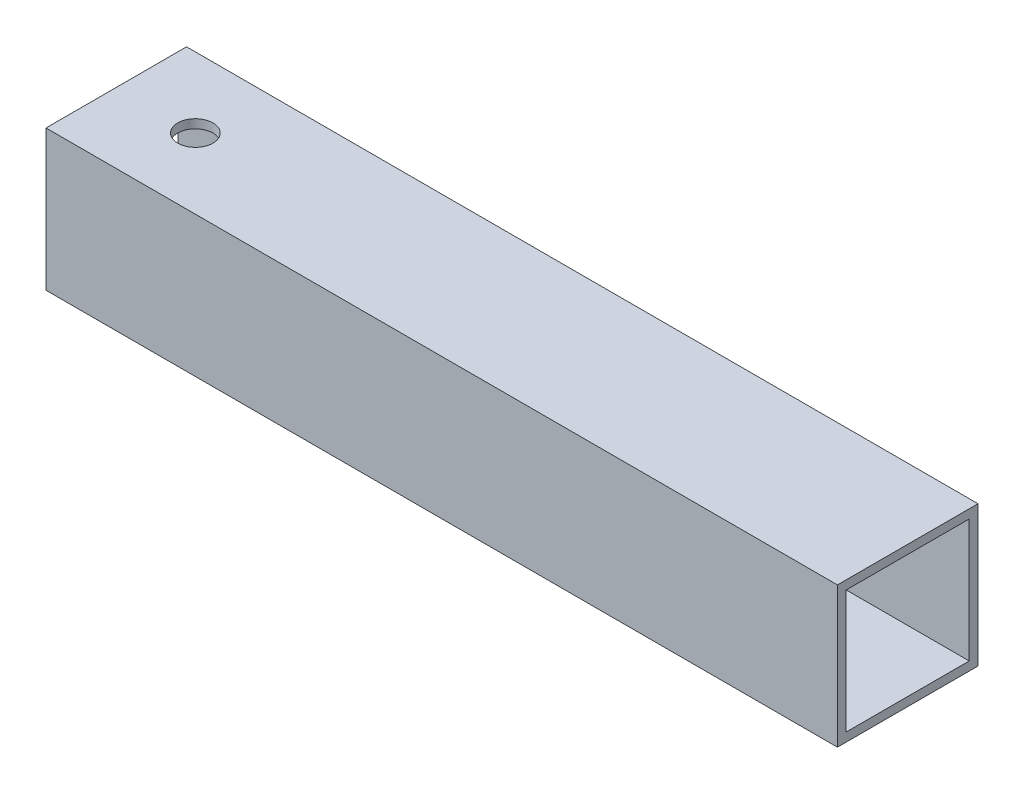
SolidWorks part; units mm, degrees
ref_plane "Front Plane" through (0, 0, 0) normal (0, 0, 1) x (1, 0, 0)
ref_plane "Top Plane" through (0, 0, 0) normal (0, 1, 0) x (1, 0, 0)
ref_plane "Right Plane" through (0, 0, 0) normal (1, 0, 0) x (0, 0, -1)
sketch "Sketch1" plane through (0, 0, 0) normal (1, 0, 0) x (0, 0, -1)
  line L1 (11.1125, -11.1125) -> (-11.1125, -11.1125)
  line L2 (11.1125, -11.1125) -> (11.1125, 11.1125)
  line L3 (11.1125, 11.1125) -> (-11.1125, 11.1125)
  line L4 (-11.1125, -11.1125) -> (-11.1125, 11.1125)
  line L5 (11.1125, -11.1125) -> (-11.1125, 11.1125) construction
  line L6 (11.1125, 11.1125) -> (-11.1125, -11.1125) construction
  line L7 (12.7, -12.7) -> (-12.7, -12.7)
  line L8 (12.7, -12.7) -> (12.7, 12.7)
  line L9 (12.7, 12.7) -> (-12.7, 12.7)
  line L10 (-12.7, -12.7) -> (-12.7, 12.7)
  line L11 (12.7, -12.7) -> (-12.7, 12.7) construction
  line L12 (12.7, 12.7) -> (-12.7, -12.7) construction
  point P0 (0, 0)
  point P6 (0, 0)
  dimension "D1" = 25.4
  dimension "D2" = 22.225
extrude "Boss-Extrude1" add sketch "Sketch1" along normal blind 143.002
sketch "Sketch2" plane through (0, 12.7, 0) normal (0, 1, 0) x (1, 0, 0)
  line L0 (0, 12.7) -> (0, -12.7) construction
  circle A0 centre (14.2875, 0) radius 3.175
  point P4 (14.2875, 0)
  dimension "D1" = 6.35
  dimension "D2" = 14.2875
extrude "Cut-Extrude1" cut sketch "Sketch2" against normal blind 143.002
